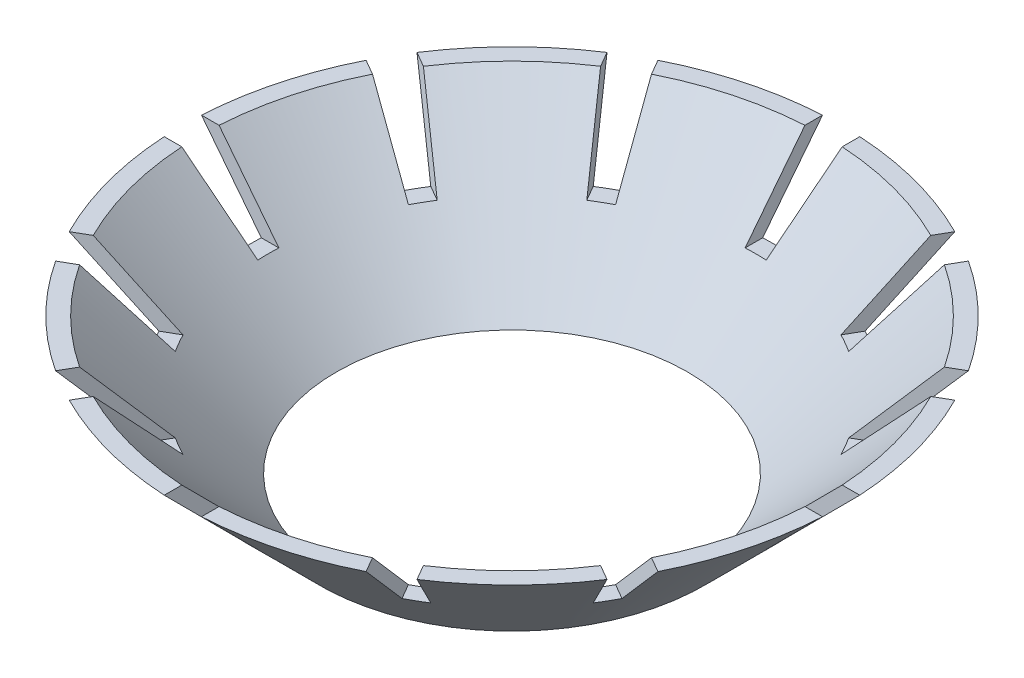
SolidWorks part; units mm, degrees
ref_plane "Plane1" through (0, 0, 0) normal (0, 0, 1) x (1, 0, 0)
ref_plane "Plane2" through (0, 0, 0) normal (0, 1, 0) x (1, 0, 0)
ref_plane "Plane3" through (0, 0, 0) normal (1, 0, 0) x (0, 0, -1)
sketch "Sketch1" plane through (0, 0, 0) normal (1, 0, 0) x (0, 0, -1)
  line L0 (0, -30) -> (0, 30) construction
  line L1 (8.5, 0) -> (15.1, 6.6)
  line L2 (8.5, 0) -> (9.3485, 0)
  line L3 (9.3485, 0) -> (15.9485, 6.6)
  line L4 (15.1, 6.6) -> (15.9485, 6.6)
  dimension "D1" = 45
  dimension "InsideDia" = 17
  dimension "OutsideDia" = 30.2
  dimension "Thickness" = 0.6
revolve "Base-Revolve" add sketch "Sketch1" angle 360 about L0
sketch "Sketch2" plane through (0, 0, 0) normal (0, 0, 1) x (1, 0, 0)
  line L0 (0, 3.3) -> (0, 7.6) construction
  line L1 (-0.51, 3.3) -> (0.51, 3.3)
  line L2 (0, -30) -> (0, 30) construction
  line L3 (-1.02, 7.6) -> (1.02, 7.6)
  line L4 (-0.51, 3.3) -> (-1.02, 7.6)
  line L5 (0.51, 3.3) -> (1.02, 7.6)
  dimension "D1" = 3.3
  dimension "D2" = 1.02
  dimension "D3" = 4.3
  dimension "D4" = 2.04
extrude "Cut-Extrude1" cut sketch "Sketch2" against normal through all
pattern_circular "CirPattern1" count 12 over 360 about axis through (0, 0, 0) along (0, 1, 0) of "Cut-Extrude1"
equation "\"D1@Sketch2\" =  ( \"OutsideDia@Sketch1\" - \"InsideDia@Sketch1\" )  / 4"
equation "\"D2@Sketch2\" = \"InsideDia@Sketch1\" * .06"
equation "\"D4@Sketch2\" = \"D2@Sketch2\" * 2"
equation "\"D3@Sketch2\" = \"D1@Sketch2\" + 1"
